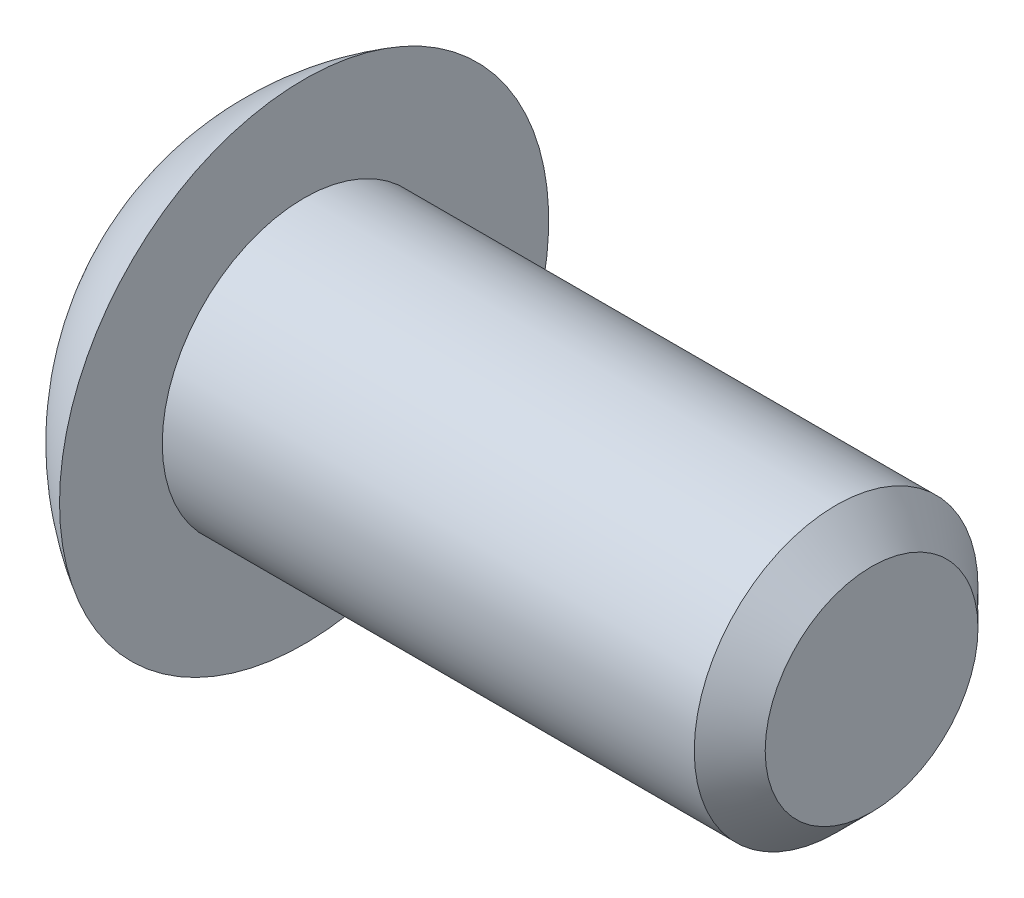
SolidWorks part; units mm, degrees
ref_plane "Plan de face" through (0, 0, 0) normal (0, 0, 1) x (1, 0, 0)
ref_plane "Plan de dessus" through (0, 0, 0) normal (0, 1, 0) x (1, 0, 0)
ref_plane "Plan de droite" through (0, 0, 0) normal (1, 0, 0) x (0, 0, -1)
sketch "Esquisse1" plane through (0, 0, 0) normal (0, 0, 1) x (1, 0, 0)
  line L0 (-40.8372, 2.0001) -> (-40.8372, 3.4484)
  line L1 (-40.8372, 2.0001) -> (-32.8372, 2.0001)
  line L3 (-42.8372, 0.0001) -> (-32.8372, 0.0001)
  line L4 (-32.8372, 2.0001) -> (-32.8372, 0.0001)
  arc A0 (-40.8372, 3.4484) -> (-42.8372, 0.0001) centre (-38.8372, -0.0157) ccw
  dimension "D2" = 4
  dimension "D1" = 2
  dimension "D3" = 10
  dimension "D4" = 8
revolve "Révolution1" add sketch "Esquisse1" angle 360 about L3
chamfer "Chanfrein1" distance 0.5 angle 45 1 edges at (-32.8372, 0.0001, 2)
